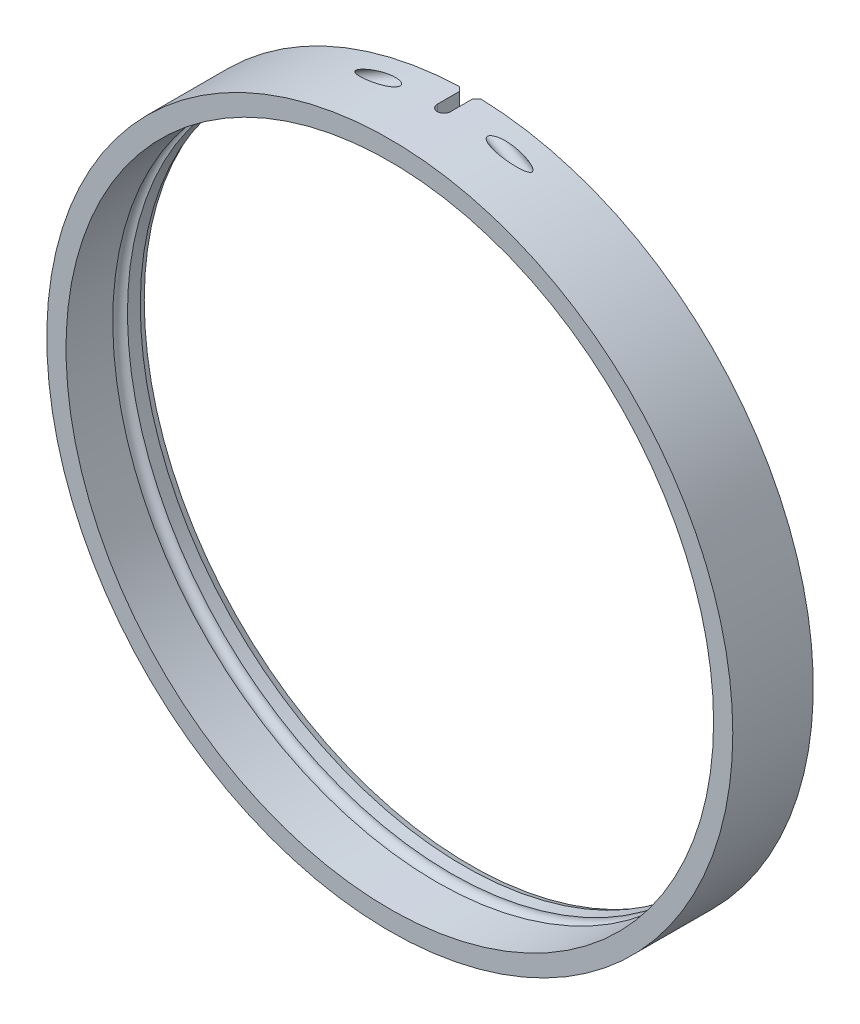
SolidWorks part; units mm, degrees
ref_plane "Front Plane" through (0, 0, 0) normal (0, 0, 1) x (1, 0, 0)
ref_plane "Top Plane" through (0, 0, 0) normal (0, 1, 0) x (1, 0, 0)
ref_plane "Right Plane" through (0, 0, 0) normal (1, 0, 0) x (0, 0, -1)
imported_body "Imported1"
sketch "Sketch1" plane through (0, 0, -39.1) normal (0, 0, -1) x (-1, 0, 0)
  circle A0 centre (0, 0) radius 90.2181
extrude "Cut-Extrude1" cut sketch "Sketch1" against normal through all
sketch "Sketch2" plane through (0, 0, -39.1) normal (0, 0, 1) x (1, 0, 0)
  circle A0 centre (0, 0) radius 83.185
  circle A1 centre (0, 0) radius 78.5254
extrude "Boss-Extrude1" add sketch "Sketch2" along normal blind 7.62
sketch "Sketch3" plane through (0, 0, -51) normal (0, 0, -1) x (-1, 0, 0)
  line L0 (0, 0) -> (0, 83.185)
  arc A0 (1.5875, 83.1698) -> (-1.5875, 83.1698) centre (0, 0) ccw construction
ref_plane "Plane1" through (0, 83.185, 0) normal (0, 1, 0) x (1, 0, 0)
sketch "Sketch4" plane through (0, 83.185, 0) normal (0, 1, 0) x (1, 0, 0)
  line L0 (0, 44.6) -> (10.5804, 44.6)
  line L1 (10.5804, 44.6) -> (21.362, 44.6)
  line L2 (15.9712, 44.6) -> (15.9712, 37.9192)
  line L3 (0, 44.6) -> (0, 37.9192)
  line L4 (0, 37.9192) -> (15.9712, 37.9192)
  spline S1 degree 3 number of poles 65 (10.5804, 44.6) -> (10.5804, 44.6) construction
